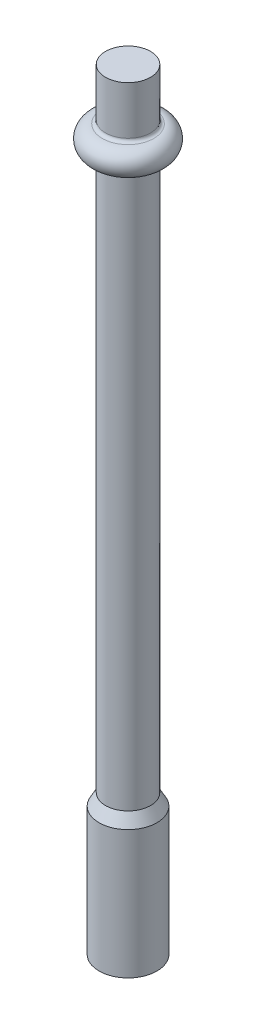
SolidWorks part; units mm, degrees
ref_plane "Front" through (0, 0, 0) normal (0, 0, 1) x (1, 0, 0)
ref_plane "Top" through (0, 0, 0) normal (0, 1, 0) x (1, 0, 0)
ref_plane "Right" through (0, 0, 0) normal (1, 0, 0) x (0, 0, -1)
sketch "Sketch1" plane through (0, 0, 0) normal (0, 0, 1) x (1, 0, 0)
  line L0 (0, 0) -> (0, 120)
  line L1 (0, 120) -> (3.5, 120)
  line L2 (3.5, 120) -> (3.5, 112.5)
  line L3 (0, 0) -> (4.5, 0)
  line L4 (3.5, 21.8102) -> (3.5, 107.5)
  line L5 (4.5, 0) -> (4.5, 20)
  line L6 (4.5, 20) -> (3.5, 21.8102)
  arc A0 (3.5, 112.5) -> (4, 112) centre (4, 112.5) ccw
  arc A1 (4, 112) -> (4, 108) centre (4, 110) cw
  arc A2 (4, 108) -> (3.5, 107.5) centre (4, 107.5) ccw
  dimension "D1" = 3.5
  dimension "D2" = 0.5
  dimension "D3" = 2
  dimension "D4" = 4.5
  dimension "D5" = 10
  dimension "D6" = 110
  dimension "D7" = 20
revolve "Revolve1" add sketch "Sketch1" angle 360 about L0
